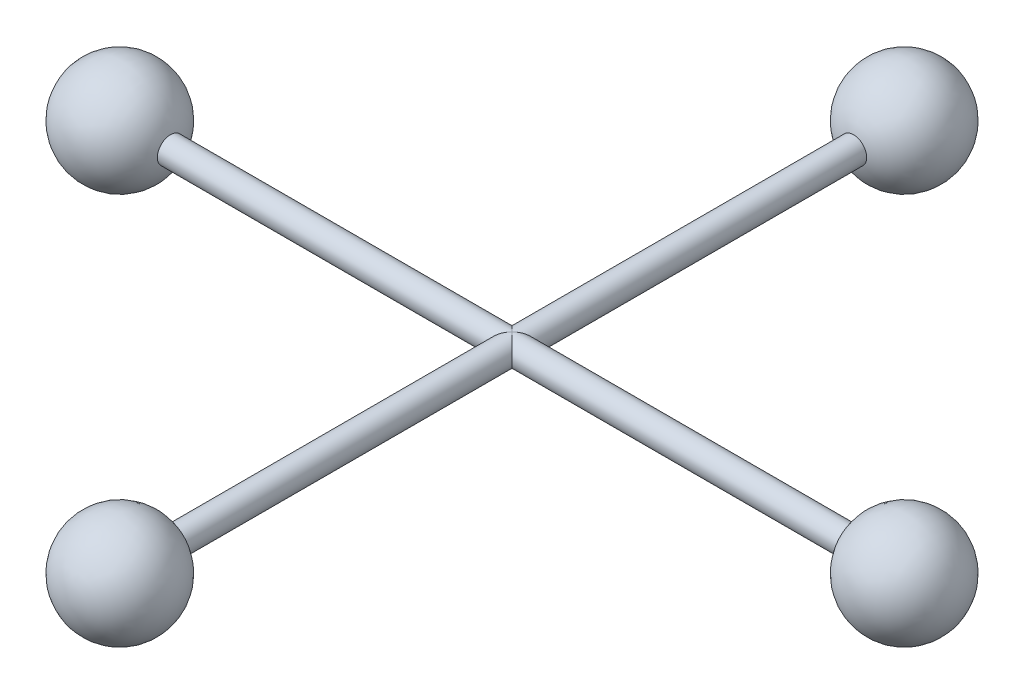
SolidWorks part; units mm, degrees
ref_plane "Plan de face" through (0, 0, 0) normal (0, 0, 1) x (1, 0, 0)
ref_plane "Plan de dessus" through (0, 0, 0) normal (0, 1, 0) x (1, 0, 0)
ref_plane "Plan de droite" through (0, 0, 0) normal (1, 0, 0) x (0, 0, -1)
sketch "Esquisse1" plane through (0, 0, 0) normal (0, 0, 1) x (1, 0, 0)
  line L0 (0, 0) -> (-68, 0) construction
  line L1 (-52.254, 2) -> (0, 2)
  arc A0 (-52.254, 2) -> (-68, 0) centre (-60, 0) ccw
  dimension "D1" = 8
  dimension "D3" = 60
  dimension "D2" = 4
surface "Surface-Révolution1" sketch "Esquisse1" parameters "D1"=360
sketch "Esquisse2" plane through (0, 0, 0) normal (1, 0, 0) x (0, 0, -1)
  line L0 (0, 0) -> (0, 23.3824) construction
pattern_circular "Répétition circulaire1" count 4 every 90 about axis through (0, 0, 0) along (0, 1, 0)
sketch "Esquisse4" plane through (0, 0, 0) normal (1, 0, 0) x (0, 0, -1)
  point P0 (60, 0)
  point P1 (-60, 0)
  dimension "D1" = 60
  dimension "D2" = 60
sketch "Esquisse6" plane through (0, 0, 0) normal (0, 0, 1) x (1, 0, 0)
  point P0 (-60, 0)
  point P1 (60, 0)
